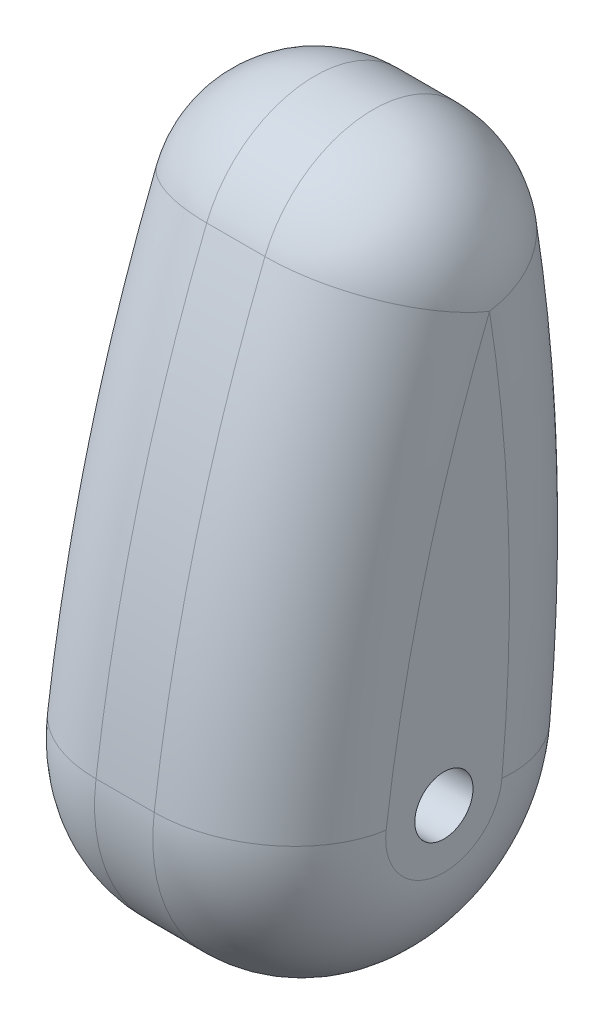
SolidWorks part; units mm, degrees
ref_plane "XY" through (0, 0, 0) normal (0, 0, 1) x (1, 0, 0)
ref_plane "YZ" through (0, 0, 0) normal (0, 1, 0) x (1, 0, 0)
ref_plane "XZ" through (0, 0, 0) normal (1, 0, 0) x (0, 0, -1)
sketch "Sketch8" plane through (0, 0, 0) normal (1, 0, 0) x (0, 0, -1)
  line L0 (5.9396, 192.7601) -> (25.8227, 369.4448) construction
  line L1 (0, 432.2232) -> (0, -432.2232) construction
  arc A0 (-69.6376, 202.4822) -> (81.7874, 185.4418) centre (5.9396, 192.7601) ccw
  arc A1 (76.0022, 377.3605) -> (-21.3425, 388.3151) centre (25.8227, 369.4448) ccw
  arc A2 (-69.6376, 202.4822) -> (-21.3425, 388.3151) centre (686.1348, 105.2605) cw
  arc A3 (76.0022, 377.3605) -> (81.7874, 185.4418) centre (-676.6902, 258.6247) cw
  dimension "D2" = 50.8
  dimension "D4" = 76.2
  dimension "D5" = 762
  dimension "D6" = 762
  dimension "D1" = 6.421
  dimension "D3" = 177.8
extrude "Base-Extrude" add sketch "Sketch8" along normal mid plane 127
fillet "Fillet1" radius 50.8
sketch "Sketch9" plane through (-63.5, 0, 0) normal (-1, 0, 0) x (0, 0, 1)
  circle A0 centre (-5.9396, 192.7601) radius 12.7
  arc A1 (-31.2222, 190.3206) -> (19.2528, 196.0008) centre (-5.9396, 192.7601) ccw construction
  dimension "D1" = 25.4
extrude "Cut-Extrude1" cut sketch "Sketch9" against normal through all
